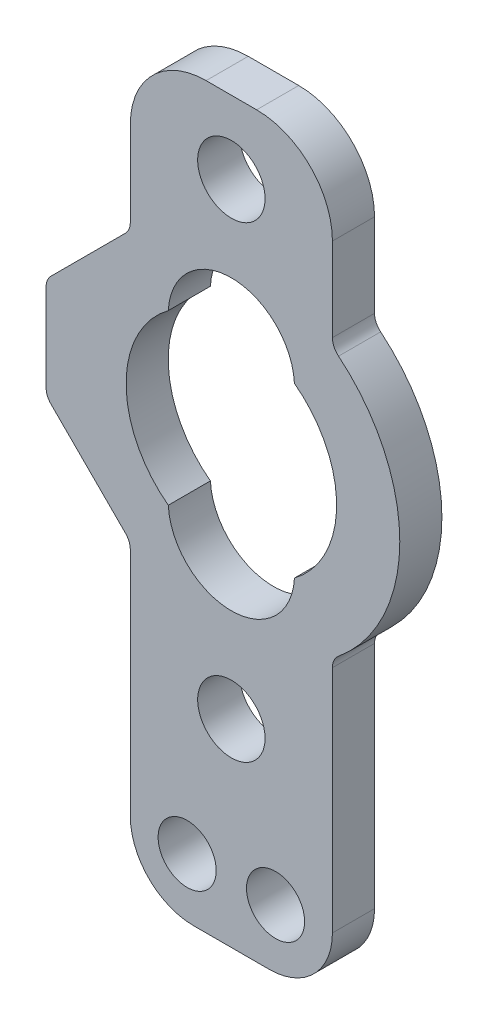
SolidWorks part; units mm, degrees
ref_plane "Plan1" through (0, 0, 0) normal (0, 0, 1) x (1, 0, 0)
ref_plane "Plan2" through (0, 0, 0) normal (0, 1, 0) x (1, 0, 0)
ref_plane "Plan3" through (0, 0, 0) normal (1, 0, 0) x (0, 0, -1)
sketch "Esquisse1" plane through (0, 0, 0) normal (0, 0, 1) x (1, 0, 0)
  line L0 (0, 83) -> (0, -72) construction
  line L1 (-4.5, 0) -> (4.5, 0)
  line L2 (12, 7.5) -> (12, 34.7794)
  line L3 (-12, 7.5) -> (-12, 34.9216)
  line L4 (12, 68.7206) -> (12, 78.65)
  line L5 (-12, 68.5784) -> (-12, 78.65)
  line L6 (3, 87.65) -> (-3, 87.65)
  line L7 (-63, 51.75) -> (65, 51.75) construction
  line L8 (-12.5858, 67.1642) -> (-21.4142, 58.3358)
  line L9 (-12.5858, 36.3358) -> (-21.4142, 45.1642)
  line L10 (-22, 56.9216) -> (-22, 46.5784)
  line L11 (-16, 23.5) -> (22, 23.5) construction
  line L12 (-15, 7) -> (17, 7) construction
  line L13 (-5.25, 17) -> (-5.25, 4) construction
  line L14 (-29, 79) -> (40, 79) construction
  arc A0 (12.7273, 67.1778) -> (12.7273, 36.3222) centre (0, 51.75) cw
  arc A1 (12, 7.5) -> (4.5, 0) centre (4.5, 7.5) cw
  arc A2 (-4.5, 0) -> (-12, 7.5) centre (-4.5, 7.5) cw
  arc A3 (-3, 87.65) -> (-12, 78.65) centre (-3, 78.65) ccw
  arc A4 (3, 87.65) -> (12, 78.65) centre (3, 78.65) cw
  arc A5 (-12.5858, 36.3358) -> (-12, 34.9216) centre (-14, 34.9216) cw
  arc A6 (-22, 46.5784) -> (-21.4142, 45.1642) centre (-20, 46.5784) ccw
  arc A7 (-22, 56.9216) -> (-21.4142, 58.3358) centre (-20, 56.9216) cw
  arc A8 (12.7273, 36.3222) -> (12, 34.7794) centre (14, 34.7794) ccw
  arc A9 (12.7273, 67.1778) -> (12, 68.7206) centre (14, 68.7206) cw
  arc A10 (-12.5858, 67.1642) -> (-12, 68.5784) centre (-14, 68.5784) ccw
  circle A11 centre (-5.25, 7) radius 3.45
  circle A12 centre (5.25, 7) radius 3.45
  circle A13 centre (0, 23.5) radius 4
  arc A14 (7.4902, 41.7427) -> (7.4902, 61.7573) centre (0, 51.75) ccw
  arc A15 (-7.4902, 41.7427) -> (7.4902, 41.7427) centre (0, 42.125) ccw
  arc A16 (-7.4902, 61.7573) -> (7.4902, 61.7573) centre (0, 61.375) cw
  arc A17 (-7.4902, 61.7573) -> (-7.4902, 41.7427) centre (0, 51.75) ccw
  circle A18 centre (0, 79) radius 4
  point P6 (0, 0)
  point P13 (0, 87.65)
  point P19 (-22, 51.75)
  point P21 (12, 0)
  point P24 (-12, 0)
  point P27 (-12, 87.65)
  point P30 (12, 87.65)
  point P33 (-12, 35.75)
  point P36 (-22, 45.75)
  point P39 (-22, 57.75)
  point P42 (12, 35.75)
  point P45 (12, 67.75)
  point P48 (-12, 67.75)
  dimension "D4" = 20
  dimension "D7" = 7.5
  dimension "D8" = 9
  dimension "D9" = 2
  dimension "D10" = 2
  dimension "D11" = 2
  dimension "D15" = 6.9
  dimension "D16" = 8
  dimension "D17" = 25
  dimension "D18" = 34.25
  dimension "D19" = 15
  dimension "D21" = 8
  dimension "D1" = 24
  dimension "D2" = 35.9
  dimension "D3" = 87.65
  dimension "D5" = 135
  dimension "D6" = 22
  dimension "D12" = 28.25
  dimension "D13" = 16.5
  dimension "D14" = 5.25
  dimension "D20" = 27.25
extrude "Base-Extrusion" add sketch "Esquisse1" along normal blind 5
sketch "Esquisse2" [suppressed] plane through (0, 0, 0) normal (0, 0, -1) x (-1, 0, 0)
  line L0 (0, 23) -> (0, -3) construction
  circle A0 centre (5.25, 7) radius 3.45
  circle A1 centre (5.25, 7) radius 3 construction
  circle A2 centre (-5.25, 7) radius 3.45
  dimension "D1" = 6.9
extrude "Enlèv. mat.-Extru.1" [suppressed] cut sketch "Esquisse2" against normal blind 1.5
